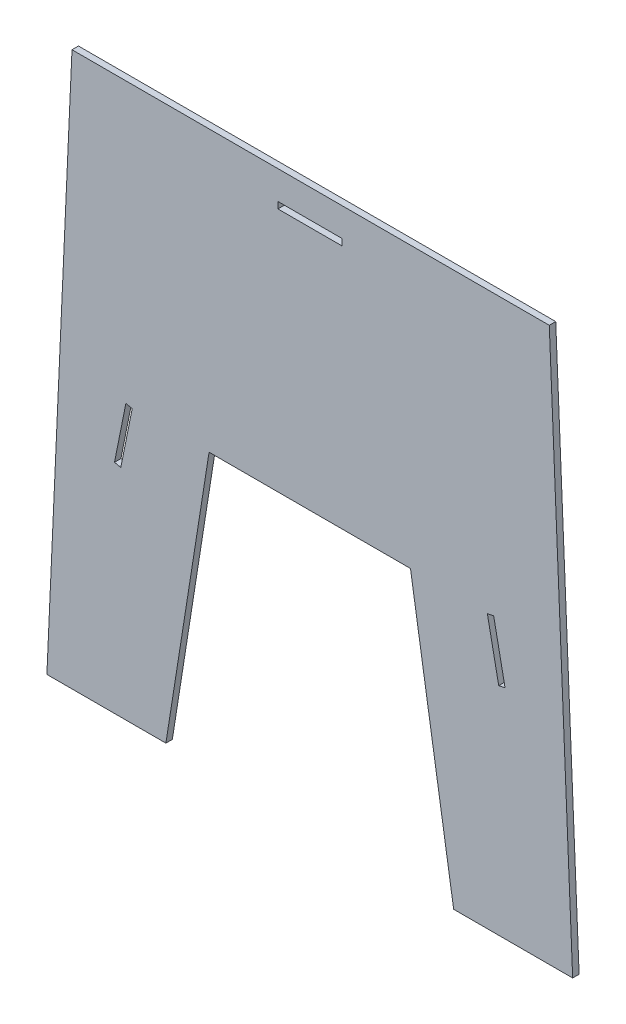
SolidWorks part; units mm, degrees
ref_plane "Front Plane" through (0, 0, 0) normal (0, 0, 1) x (1, 0, 0)
ref_plane "Top Plane" through (0, 0, 0) normal (0, 1, 0) x (1, 0, 0)
ref_plane "Right Plane" through (0, 0, 0) normal (1, 0, 0) x (0, 0, -1)
sketch "Sketch1" plane through (0, 0, 0) normal (0, 0, 1) x (1, 0, 0)
  line L0 (-62.1421, -11.7458) -> (-56.213, 118.9461)
  line L1 (-56.213, 118.9461) -> (56.4665, 118.9461)
  line L2 (56.4665, 118.9461) -> (61.9859, -11.7458)
  line L3 (-62.1421, -11.7458) -> (-34.0484, -11.7458)
  line L4 (-0.0781, -11.7458) -> (-0.0781, -41.8993) construction
  line L5 (-23.8521, 52.8381) -> (23.6959, 52.8381)
  line L6 (-23.8521, 52.8381) -> (-34.0484, -11.7458)
  line L8 (23.6959, 52.8381) -> (33.8922, -11.7458)
  line L9 (-8.8652, 111.4688) -> (8.8283, 111.4688) construction
  line L10 (61.9859, -11.7458) -> (33.8922, -11.7458)
  line L11 (46.0269, 39.6055) -> (44.5328, 39.3053)
  line L12 (-43.4936, 52.9882) -> (-46.1831, 39.6055)
  line L13 (-41.9995, 52.6879) -> (-44.689, 39.3053)
  line L14 (-43.4936, 52.9882) -> (-41.9995, 52.6879)
  line L15 (-46.1831, 39.6055) -> (-44.689, 39.3053)
  line L16 (43.3374, 52.9882) -> (41.8433, 52.6879)
  line L17 (41.8433, 52.6879) -> (44.5328, 39.3053)
  line L18 (43.3374, 52.9882) -> (46.0269, 39.6055)
  line L19 (-7.597, 110.7068) -> (7.5602, 110.7068)
  line L20 (-7.597, 110.7068) -> (-7.597, 112.2308)
  line L21 (-7.597, 112.2308) -> (7.5602, 112.2308)
  line L22 (7.5602, 110.7068) -> (7.5602, 112.2308)
  line L23 (-7.597, 110.7068) -> (7.5602, 112.2308) construction
  line L24 (-7.597, 112.2308) -> (7.5602, 110.7068) construction
  circle A0 centre (0, 25.1412) radius 25.4 construction
  point P13 (-0.0184, 111.4688)
extrude "Boss-Extrude1" add sketch "Sketch1" along normal blind 1.524
